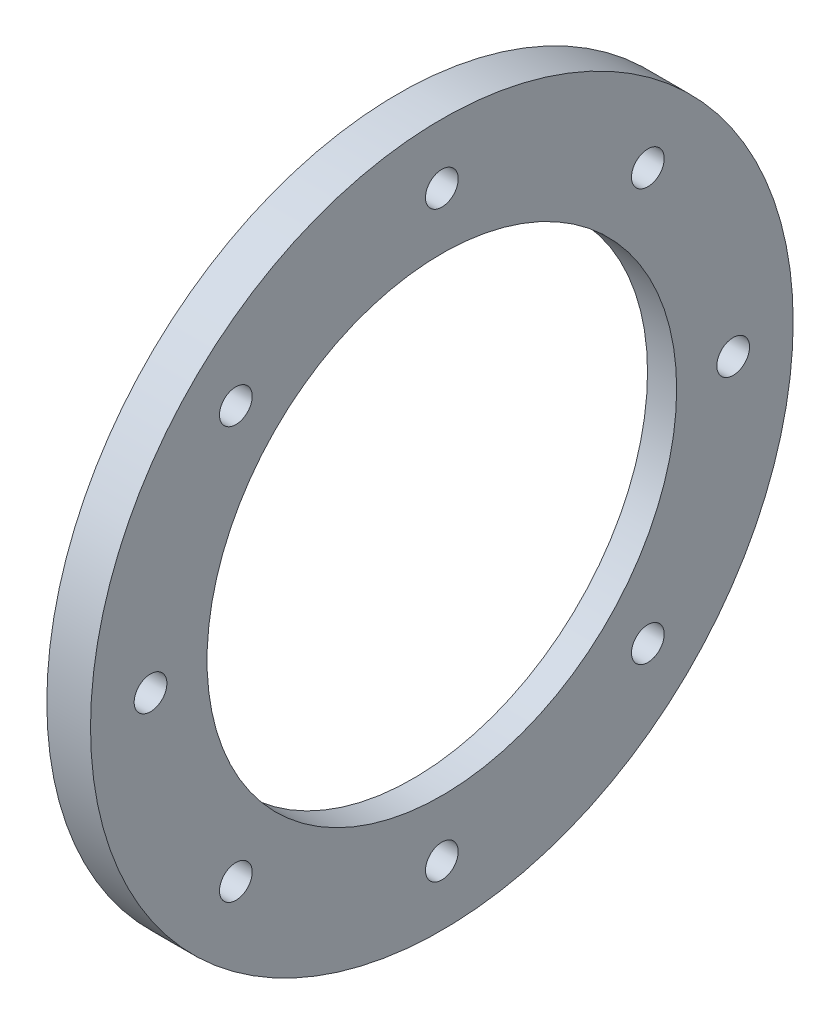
SolidWorks part; units mm, degrees
ref_plane "Front" through (0, 0, 0) normal (0, 0, 1) x (1, 0, 0)
ref_plane "Top" through (0, 0, 0) normal (0, 1, 0) x (1, 0, 0)
ref_plane "Right" through (0, 0, 0) normal (1, 0, 0) x (0, 0, -1)
sketch "Sketch1" plane through (0, 0, 0) normal (0, 0, 1) x (1, 0, 0)
  line L1 (-222.25, 76.581) -> (-212.725, 76.581)
  line L2 (-222.25, 76.581) -> (-222.25, 59.9042)
  line L4 (-212.725, 76.581) -> (-212.725, 54.356)
  line L6 (-222.25, 50.0121) -> (-222.25, -51.5879) construction
  line L8 (-219.075, 51.181) -> (-212.725, 51.181)
  line L9 (-212.725, 54.356) -> (-212.725, 51.181)
  line L10 (0, 0) -> (-218.6364, 0)
  line L11 (-219.075, 51.181) -> (-222.25, 59.9042)
  dimension "D1" = 9.525
  dimension "D2" = 20
  dimension "D3" = 25.4
  dimension "D4" = 51.181
  dimension "D5" = 222.25
  dimension "D6" = 3.175
  dimension "D7" = 3.175
revolve "Revolve1" add sketch "Sketch1" angle 360 about L10
hole_wizard "K (0.281) Diameter Hole2" positions "Sketch5" profile "Sketch4" hole size "K" standard "Ansi Inch"
sketch "Sketch5" plane through (-222.25, 0, 0) normal (-1, 0, 0) x (0, 0, 1)
  line L0 (0, 63.5) -> (0, 0)
  line L1 (0, 0) -> (44.9013, 44.9013)
  circle A0 centre (0, 0) radius 63.5
  point P0 (0, 63.5)
  point P22 (44.9013, 44.9013)
  point P23 (63.5, 0)
  point P24 (44.9013, -44.9013)
  point P25 (0, -63.5)
  point P26 (-44.9013, -44.9013)
  point P27 (-63.5, 0)
  point P28 (-44.9013, 44.9013)
  dimension "D1" = 127
  dimension "D2" = 45
sketch "Sketch4" plane through (-222.25, 63.5, 0) normal (0, 1, 0) x (0, 0, 1)
  line L0 (0, 0) -> (0, 9.525)
  line L1 (0, 9.525) -> (3.5687, 9.525)
  line L2 (3.5687, 9.525) -> (3.5687, 0)
  line L5 (3.5687, 0) -> (0, 0)
  line L11 (0, -6.35) -> (0, 107.95) construction
  dimension "Thru Hole Dia." = 7.1374
  dimension "Thru Hole Depth" = 9.525
